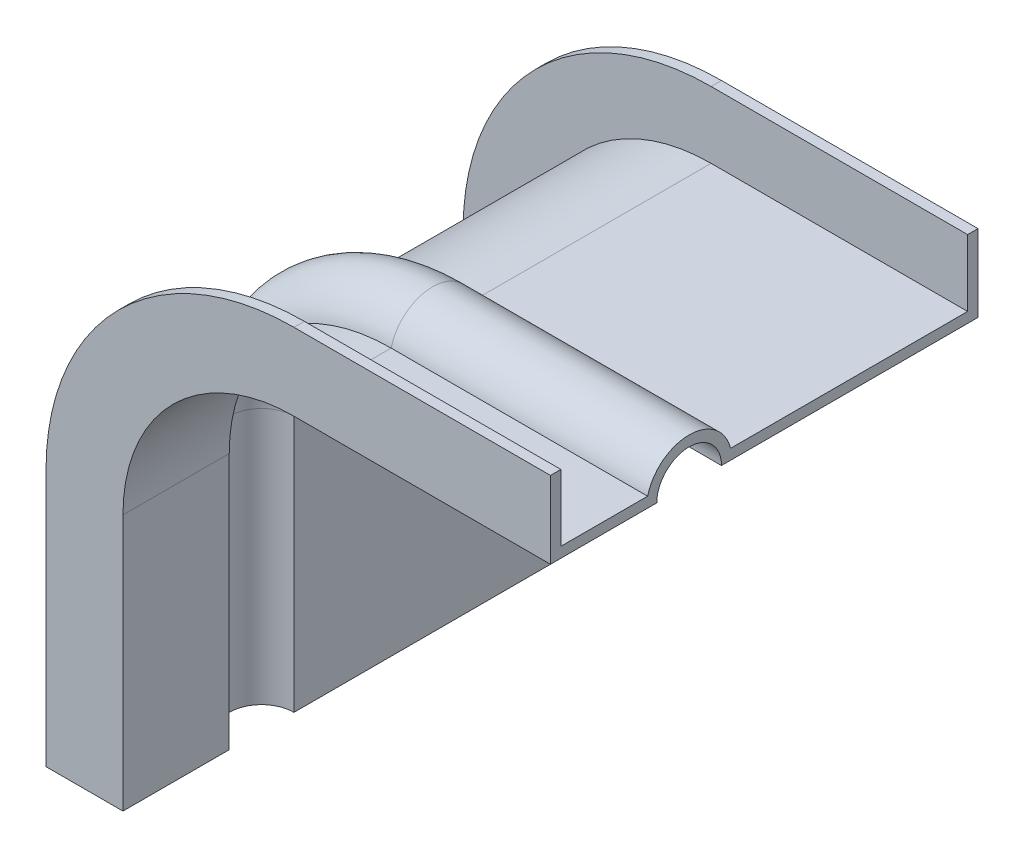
SolidWorks part; units mm, degrees
ref_plane "Front Plane" through (0, 0, 0) normal (0, 0, 1) x (1, 0, 0)
ref_plane "Top Plane" through (0, 0, 0) normal (0, 1, 0) x (1, 0, 0)
ref_plane "Right Plane" through (0, 0, 0) normal (1, 0, 0) x (0, 0, -1)
sketch "Sketch1" plane through (0, 0, 0) normal (0, 0, 1) x (1, 0, 0)
  line L0 (0, 0) -> (0, 30)
  line L1 (20, 50) -> (50, 50)
  arc A0 (0, 30) -> (20, 50) centre (20, 30) cw
  dimension "D2" = 20
  dimension "D1" = 30
sketch "Sketch2" plane through (0, 0, 0) normal (0, 1, 0) x (1, 0, 0)
  line L0 (-9, -50) -> (-9, -48.786)
  line L1 (-9, -48.786) -> (-1.214, -48.786)
  line L2 (-1.214, -48.786) -> (-1.214, -38.6364)
  line L3 (-1.214, -28.9356) -> (-1.214, -1.214)
  line L4 (-9, -50) -> (0, -50)
  line L5 (0, -50) -> (0, -37.572)
  line L6 (0, -30) -> (0, 0)
  line L7 (0, 0) -> (-9, 0)
  line L8 (-1.214, -1.214) -> (-9, -1.214)
  line L9 (-9, -1.214) -> (-9, 0)
  arc A0 (-1.214, -28.9356) -> (-1.214, -38.6364) centre (0, -33.786) ccw
  arc A1 (0, -37.572) -> (0, -30) centre (0, -33.786) cw
  dimension "D2" = 1.214
  dimension "D3" = 5
  dimension "D7" = 1.214
  dimension "D8" = 15
  dimension "D1" = 9
  dimension "D4" = 50
  dimension "D5" = 1.214
  dimension "D6" = 1.214
sweep "Sweep1" add profiles "Sketch2" path "Sketch1"
